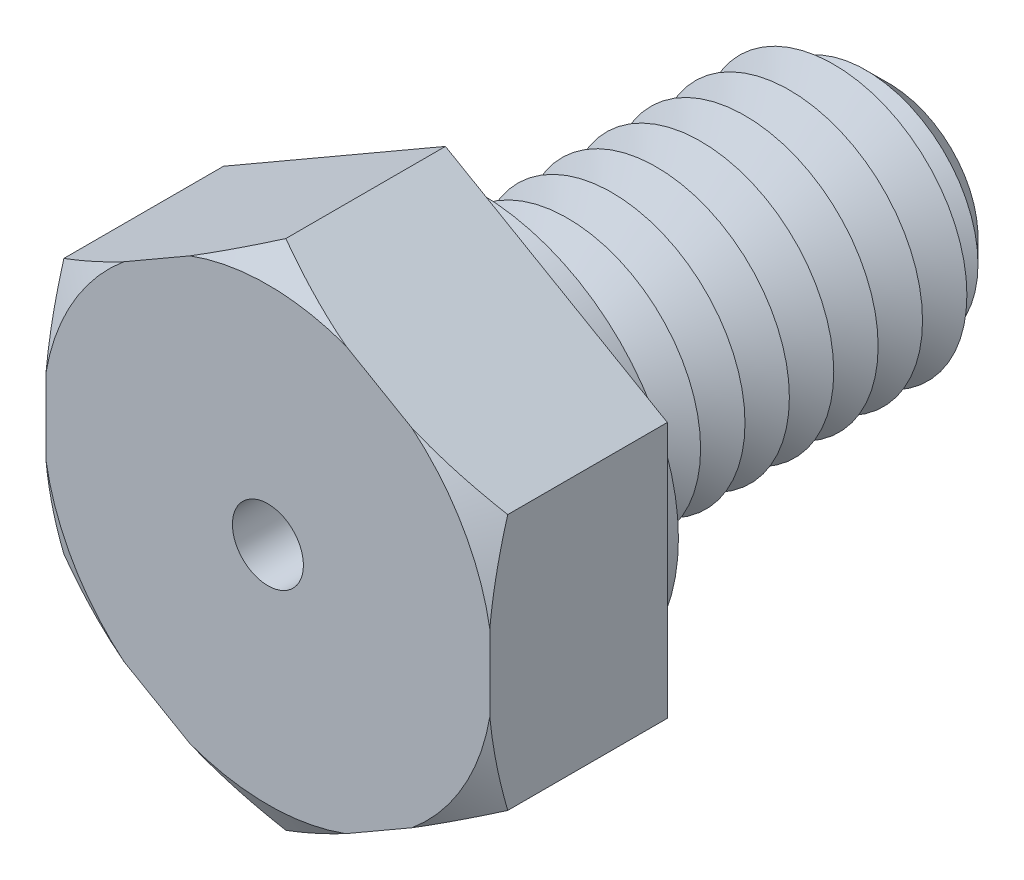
SolidWorks part; units mm, degrees
ref_plane "Front Plane" through (0, 0, 0) normal (0, 0, 1) x (1, 0, 0)
ref_plane "Top Plane" through (0, 0, 0) normal (0, 1, 0) x (1, 0, 0)
ref_plane "Right Plane" through (0, 0, 0) normal (1, 0, 0) x (0, 0, -1)
sketch "Sketch2" plane through (0, 0, 0) normal (0, 0, 1) x (1, 0, 0)
  line L1 (0, 5.7735) -> (-5, 2.8868)
  line L2 (-5, 2.8868) -> (-5, -2.8868)
  line L3 (-5, -2.8868) -> (0, -5.7735)
  line L4 (0, -5.7735) -> (5, -2.8868)
  line L5 (5, -2.8868) -> (5, 2.8868)
  line L6 (5, 2.8868) -> (0, 5.7735)
  circle A0 centre (0, 0) radius 5 construction
  dimension "D1" = 10
extrude "Boss-Extrude1" add sketch "Sketch2" along normal blind 4
sketch "Sketch3" plane through (0, 0, 0) normal (0, 0, -1) x (-1, 0, 0)
  circle A0 centre (0, 0) radius 3
  dimension "D1" = 6
extrude "Boss-Extrude2" add sketch "Sketch3" along normal blind 10
sketch "Sketch4" plane through (0, 0, 0) normal (0, 0, -1) x (-1, 0, 0)
  circle A0 centre (0, 0) radius 4.5
  dimension "D1" = 9
extrude "Boss-Extrude3" add sketch "Sketch4" along normal blind 0.75
sketch "Sketch5" plane through (0, 0, 0) normal (1, 0, 0) x (0, 0, -1)
  line L0 (-3.2117, 0) -> (6.3192, 0) construction
chamfer "Chamfer1" distance 1 angle 45 1 edges at (-3, 0, -10)
sketch "Sketch6" plane through (0, 0, 0) normal (1, 0, 0) x (0, 0, -1)
  line L0 (0.75, 3) -> (1.25, 2.134)
  line L1 (1.25, 2.134) -> (1.75, 3)
  line L2 (9, 3) -> (0.75, 3) construction
  line L3 (1.75, 3) -> (0.75, 3)
  dimension "D1" = 1
revolve "Cut-Revolve1" cut sketch "Sketch6" angle 360 about L0
pattern_linear "LPattern1" count 9 spacing 1 along (0, 0, -1) of "Cut-Revolve1"
sketch "Sketch7" plane through (0, 0, 0) normal (1, 0, 0) x (0, 0, -1)
  line L0 (-4, 5.7735) -> (-4, 5.0735)
  line L1 (-4, 2.8868) -> (-4, 5.7735) construction
  line L2 (-4, 5.0735) -> (-3.5959, 5.7735)
  line L3 (-4, 5.7735) -> (0, 5.7735) construction
  line L4 (-3.5959, 5.7735) -> (-4, 5.7735)
  dimension "D1" = 0.7
  dimension "D2" = 30
revolve "Cut-Revolve2" cut sketch "Sketch7" angle 360 about L0
sketch "Sketch8" plane through (0, 0, 4) normal (0, 0, 1) x (1, 0, 0)
  circle A0 centre (0, 0) radius 0.8
  dimension "D1" = 1.6
extrude "Cut-Extrude1" cut sketch "Sketch8" against normal up to surface (14 mm away)
